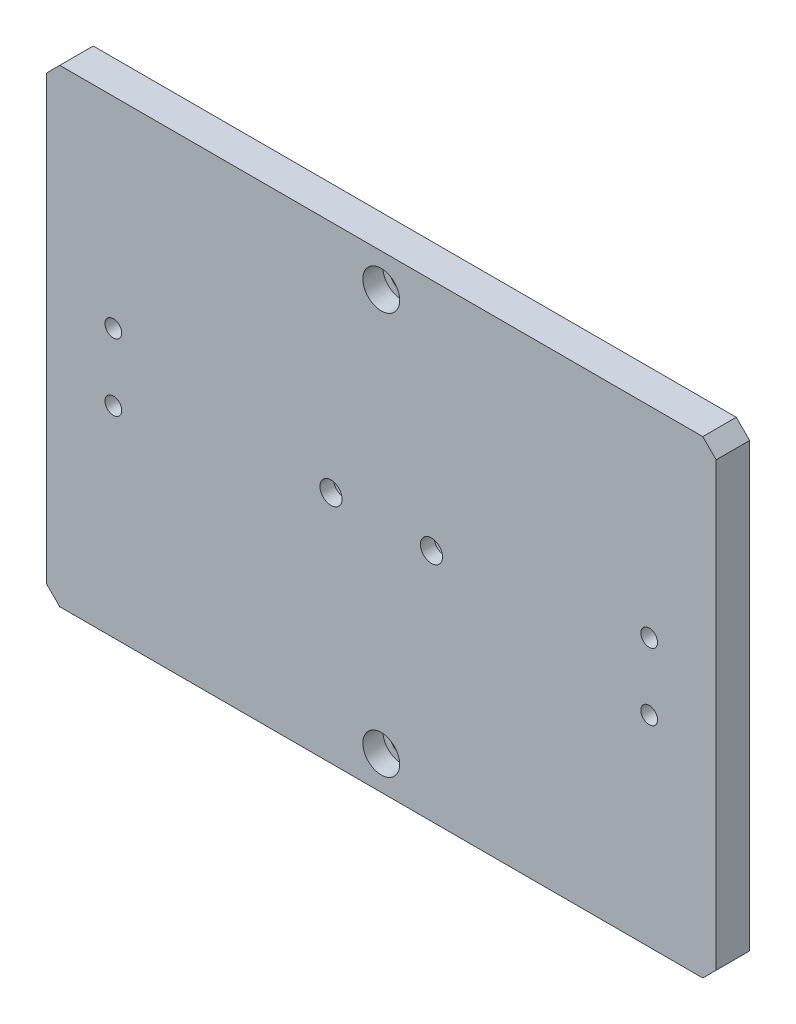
SolidWorks part; units mm, degrees
ref_plane "前基準面" through (0, 0, 0) normal (0, 0, 1) x (1, 0, 0)
ref_plane "上基準面" through (0, 0, 0) normal (0, 1, 0) x (1, 0, 0)
ref_plane "右基準面" through (0, 0, 0) normal (1, 0, 0) x (0, 0, -1)
sketch "草圖1" plane through (0, 0, 0) normal (0, 0, 1) x (1, 0, 0)
  line L1 (0, 0) -> (200, 0)
  line L2 (0, 0) -> (0, 140)
  line L3 (0, 140) -> (200, 140)
  line L4 (200, 0) -> (200, 140)
  dimension "D1" = 200
  dimension "D2" = 140
extrude "填料-伸長1" add sketch "草圖1" along normal blind 10
chamfer "導角1" distance 4 angle 45 4 edges at (200, 140, 5) (0, 140, 5) (0, 0, 5) (200, 0, 5)
hole_wizard "M6 六角承窩頭蓋螺釘的柱孔1" positions "草圖6" profile "草圖5" counterbore size "M6" standard "ISO"
sketch "草圖6" plane through (0, 0, 0) normal (0, 0, -1) x (-1, 0, 0)
  line L0 (-200, 4) -> (-200, 136) construction
  line L1 (-196, 140) -> (-4, 140) construction
  point P0 (-115, 70)
  point P1 (-85, 70)
  dimension "D1" = 30
  dimension "D2" = 85
  dimension "D3" = 70
  dimension "D4" = 70
sketch "草圖5" plane through (115, 70, 0) normal (1, 0, 0) x (0, 1, 0)
  line L0 (0, 0) -> (0, 10)
  line L1 (0, 10) -> (3.3, 10)
  line L3 (3.3, 10) -> (3.3, 6)
  line L4 (3.3, 6) -> (5.5, 6)
  line L5 (5.5, 6) -> (5.5, 0)
  line L7 (5.5, 0) -> (0, 0)
  line L11 (0, -6.35) -> (0, 107.95) construction
  dimension "貫穿孔直徑" = 6.6
  dimension "貫穿孔深度" = 10
  dimension "柱孔直徑" = 11
  dimension "柱孔深度" = 6
hole_wizard "M6 六角承窩頭蓋螺釘的柱孔2" positions "草圖8" profile "草圖7" counterbore size "M6" standard "ISO"
sketch "草圖8" plane through (0, 0, 10) normal (0, 0, 1) x (1, 0, 0)
  line L0 (196, 140) -> (4, 140) construction
  line L1 (4, 0) -> (196, 0) construction
  line L2 (0, 136) -> (0, 4) construction
  point P0 (100, 130)
  point P1 (100, 10)
  dimension "D1" = 10
  dimension "D2" = 10
  dimension "D3" = 100
  dimension "D4" = 100
sketch "草圖7" plane through (100, 130, 10) normal (1, 0, 0) x (0, -1, 0)
  line L0 (0, 0) -> (0, 10)
  line L1 (0, 10) -> (3.3, 10)
  line L3 (3.3, 10) -> (3.3, 6)
  line L4 (3.3, 6) -> (5.5, 6)
  line L5 (5.5, 6) -> (5.5, 0)
  line L7 (5.5, 0) -> (0, 0)
  line L11 (0, -6.35) -> (0, 107.95) construction
  dimension "貫穿孔直徑" = 6.6
  dimension "貫穿孔深度" = 10
  dimension "柱孔直徑" = 11
  dimension "柱孔深度" = 6
hole_wizard "M6 螺紋孔1" positions "草圖10" profile "草圖9" tap size "M6" standard "IS"
sketch "草圖10" plane through (0, 0, 10) normal (0, 0, 1) x (1, 0, 0)
  line L0 (196, 140) -> (4, 140) construction
  line L1 (0, 136) -> (0, 4) construction
  line L2 (200, 4) -> (200, 136) construction
  line L3 (200, 4) -> (200, 136) construction
  point P0 (20, 60)
  point P1 (180, 60)
  point P3 (20, 80)
  point P5 (180, 80)
  dimension "D1" = 20
  dimension "D2" = 20
  dimension "D3" = 60
  dimension "D4" = 60
  dimension "D5" = 20
  dimension "D6" = 20
  dimension "D7" = 20
sketch "草圖9" plane through (20, 60, 10) normal (1, 0, 0) x (0, -1, 0)
  line L0 (0, 0) -> (0, 16.5022)
  line L1 (0, 16.5022) -> (2.5, 15)
  line L2 (2.5, 15) -> (2.5, 0)
  line L5 (2.5, 0) -> (0, 0)
  line L10 (0, 16.5022) -> (-2.5, 15) construction
  line L11 (0, -6.35) -> (0, 107.95) construction
  dimension "螺孔鑽直徑" = 5
  dimension "螺孔鑽深度" = 15
  dimension "導頭角度" = 118
